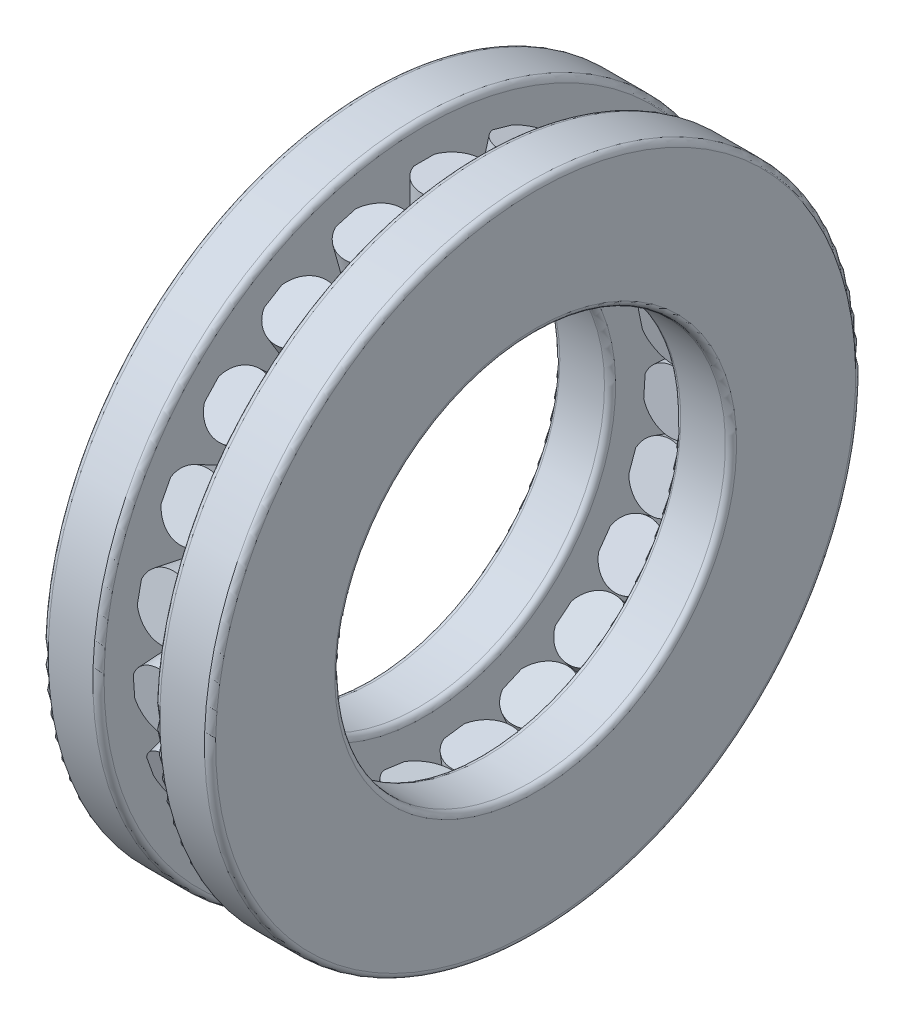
SolidWorks part; units mm, degrees
ref_plane "Front" through (0, 0, 0) normal (0, 0, 1) x (1, 0, 0)
ref_plane "Top" through (0, 0, 0) normal (0, 1, 0) x (1, 0, 0)
ref_plane "Right" through (0, 0, 0) normal (1, 0, 0) x (0, 0, -1)
sketch "Sketch1" plane through (-7.03, 10.47, 0) normal (0, 0, 1) x (0, 1, 0)
  line L0 (-10.47, 18.1553) -> (-10.47, -14.7153) construction
  line L1 (-27.97, 1.97) -> (-20.47, 1.97) construction
  line L2 (-27.97, -7.03) -> (-20.47, -7.03)
  line L3 (-27.97, -7.03) -> (-27.97, -4.03)
  line L4 (-27.97, -4.03) -> (-20.47, -4.03)
  line L5 (-20.47, -7.03) -> (-20.47, -4.03)
  dimension "XD" = 20
  dimension "DD1" = 35
  dimension "D3" = 3
  dimension "H" = 9
revolve "Revolve1" add sketch "Sketch1" angle 360 about L0
sketch "Sketch2" plane through (1.5709, -3.0291, 0) normal (0, 0, 1) x (0, -1, 0)
  line L0 (-19.5753, -0.0709) -> (17.0395, -0.0709) construction
  line L2 (-18.6541, -0.0709) -> (-18.6541, 1.5291)
  line L4 (-18.6541, 1.5291) -> (-14.9041, 1.5291)
  line L5 (-14.9041, 1.5291) -> (-14.9041, -0.0709)
  line L7 (-18.6541, -0.0709) -> (-14.9041, -0.0709)
  dimension "D1" = 3.2
  dimension "D2" = 11.875
  dimension "D3" = 3.75
  dimension "D4" = 1.5
revolve "Revolve2" add sketch "Sketch2" angle 360 about L0
sketch "Sketch3" plane through (-8.783, 8.717, 0) normal (0, 0, 1) x (0, 1, 0)
  line L0 (-8.717, 6.8297) -> (-8.717, -6.8957) construction
  line L1 (-26.217, -11.783) -> (-19.217, -11.783)
  line L2 (-26.217, -11.783) -> (-26.217, -14.783)
  line L3 (-26.217, -14.783) -> (-19.217, -14.783)
  line L4 (-19.217, -11.783) -> (-19.217, -14.783)
  line L5 (3.158, -11.883) -> (6.908, -11.883) construction
  dimension "D1" = 0.1
  dimension "D2" = 3
  dimension "XD1" = 21
  dimension "DD" = 35
revolve "Revolve3" add sketch "Sketch3" angle 360 about L0
pattern_circular "Circular-Pattern1" count 23 over 360 about axis through (0, 0, 0) along (1, 0, 0) of "Revolve2"
fillet "Fillet1" radius 0.3 8 edges at (0, -17.5, 0) (-3, -17.5, 0) (-3, -10, 0) (0, -10, 0) (3, -10.5, 0) (6, -10.5, 0) (6, -17.5, 0) (3, -17.5, 0)
equation "\"D3@Sketch1\" = \"H@Sketch1\" / 3"
equation "\"D1@Sketch2\" = \"H@Sketch1\" / 3 + 0.2"
equation "\"D4@Sketch2\" = \"D1@Sketch2\" / 2 - 0.1"
equation "\"D3@Sketch2\" =  ( \"DD1@Sketch1\" - \"XD@Sketch1\" )  / 4"
equation "\"D2@Sketch2\" = \"XD@Sketch1\" / 2 +  ( \"DD1@Sketch1\" - \"XD@Sketch1\" )  / 8"
equation "\"D1@Circular-Pattern1\" = int ( 3.14 / atn (  ( \"D1@Sketch2\" / 2 )  / sqr (  ( \"D2@Sketch2\" * \"D2@Sketch2\" )  -  ( \"D1@Sketch2\" / 2 )  *  ( \"D1@Sketch2\" / 2 )  )  )  )"
equation "\"D2@Sketch3\" = \"H@Sketch1\" / 3"
